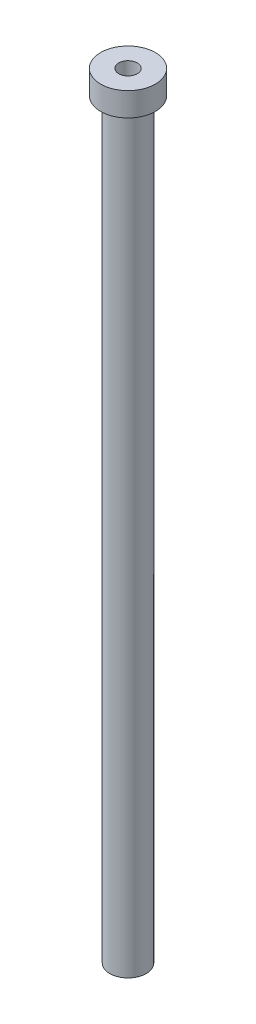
SolidWorks part; units mm, degrees
ref_plane "Ebene vorne" through (0, 0, 0) normal (0, 0, 1) x (1, 0, 0)
ref_plane "Ebene oben" through (0, 0, 0) normal (0, 1, 0) x (1, 0, 0)
ref_plane "Ebene rechts" through (0, 0, 0) normal (1, 0, 0) x (0, 0, -1)
sketch "Skizze3" plane through (0, 0, 0) normal (1, 0, 0) x (0, 0, -1)
  line L0 (0, -91.5234) -> (0, 27.1792) construction
  line L2 (-2, -2.6) -> (-2, -85)
  line L3 (-3, 0) -> (0, 0)
  line L4 (-3, 0) -> (-3, -2.6)
  line L5 (-3, -2.6) -> (-2, -2.6)
  line L7 (-2, -85) -> (0, -85)
  line L8 (0, -85) -> (0, 0)
  dimension "D1" = 3
  dimension "D2" = 2.6
  dimension "D3" = 2
  dimension "D4" = 85
revolve "Rotation3" add sketch "Skizze3" angle 360 about L0
hole_wizard "M2.5 Gewindebohrung1" positions "3D-Skizze2" profile "Skizze5" tap size "M2.5" standard "DIN"
sketch3d "3D-Skizze2"
  circle A0 centre (0, -85, 0) radius 2 construction
  circle A1 centre (0, 0, 0) radius 3 construction
  point P0 (0, 0, 0)
  point P6 (0, -85, 0)
  point P12 (0, -87, 0)
  point P15 (0, -3, 0)
sketch "Skizze5" plane through (0, 0, 0) normal (1, 0, 0) x (0, 0, 1)
  line L0 (0, 0) -> (0, 7.8659)
  line L1 (0, 7.8659) -> (1.025, 7.25)
  line L2 (1.025, 7.25) -> (1.025, 0)
  line L5 (1.025, 0) -> (0, 0)
  line L10 (0, 7.8659) -> (-1.025, 7.25) construction
  line L11 (0, -6.35) -> (0, 107.95) construction
  dimension "Bohrerdurchmesser" = 2.05
  dimension "Bohrungstiefe" = 7.25
  dimension "Spitzenwinkel" = 118
ref_plane "Ebene1" through (0, -21, 0) normal (0, 1, 0) x (-1, 0, 0)
equation "\"LÄNGE\"=0"
equation "\"BREITE\"=0"
equation "\"HÖHE\"=0"
equation "\"DURCHMESSER\"=0"
